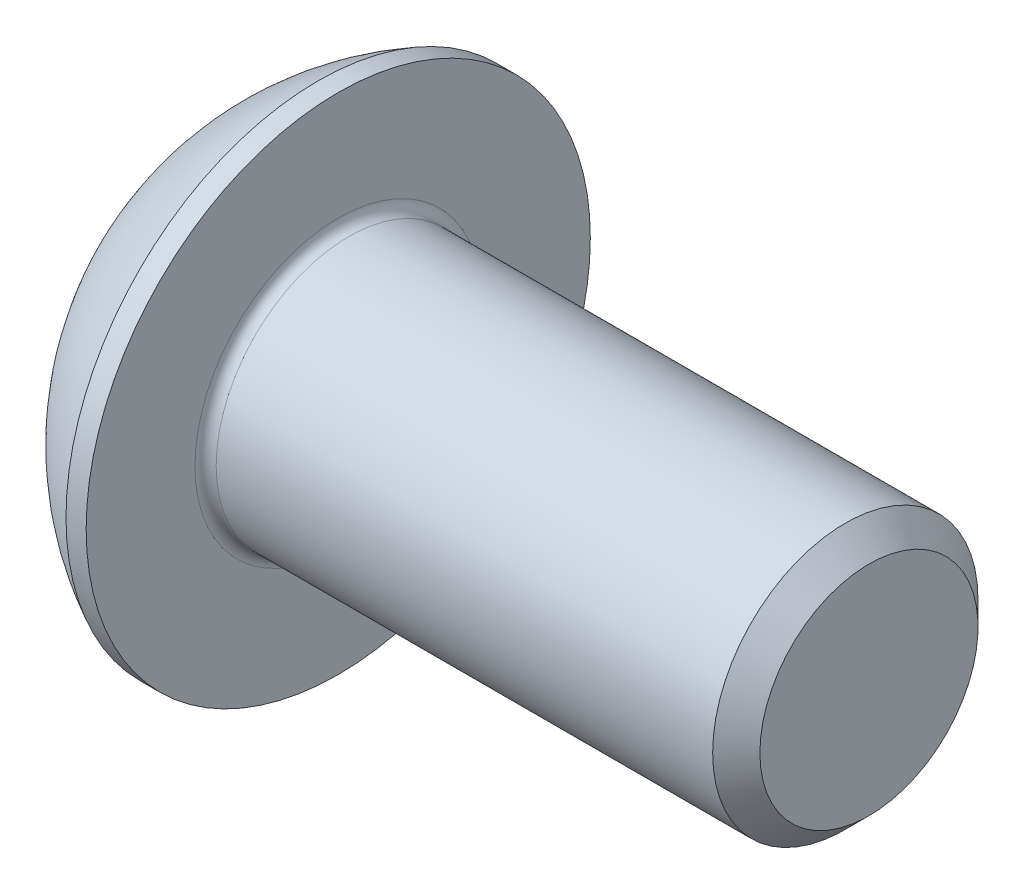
SolidWorks part; units mm, degrees
ref_plane "Plane1" through (0, 0, 0) normal (0, 0, 1) x (1, 0, 0)
ref_plane "Plane2" through (0, 0, 0) normal (0, 1, 0) x (1, 0, 0)
ref_plane "Plane3" through (0, 0, 0) normal (1, 0, 0) x (0, 0, -1)
other "Configuration Table"
sketch "BodySke" plane through (0, 0, 0) normal (0, 0, 1) x (1, 0, 0)
  line L0 (12.75, 0) -> (12.75, 2.055)
  line L1 (12.305, 2.5) -> (2.75, 2.5)
  line L2 (2.75, 2.5) -> (2.75, 4.75)
  line L3 (2.75, 4.75) -> (2.37, 4.75)
  line L4 (0, 0) -> (101.6, 0) construction
  line L5 (2.75, -4.75) -> (2.37, -4.75) construction
  line L6 (55.6768, -2.5) -> (2.75, -2.5) construction
  line L7 (12.75, 0) -> (0, 0)
  line L8 (0, 2.375) -> (0, -2.375) construction
  line L9 (0, 0) -> (0, 2.375)
  line L10 (12.75, 2.055) -> (12.305, 2.5)
  line L11 (12.75, -2.055) -> (12.305, -2.5) construction
  line L12 (3.55, 9.525) -> (3.55, -2.5) construction
  line L13 (2.75, 9.525) -> (2.75, -2.5) construction
  arc A1 (0, 2.375) -> (2.37, 4.75) centre (4.755, 0) cw
revolve "BaseBody" add sketch "BodySke" angle 360 about L4
fillet "Fillet1" radius 0.2 1 edges at (2.75, 0, 2.5)
sketch "Sketch2" plane through (0, 0, 0) normal (0, 0, 1) x (1, 0, 0)
  line L0 (0, 1.5) -> (1.56, 1.5)
  line L1 (1.56, 1.5) -> (2.426, 0)
  line L3 (2.426, 0) -> (0, 0)
  line L4 (0, 0) -> (0, 1.5)
  line L5 (0, -1.5) -> (1.56, -1.5) construction
  line L6 (0, 0) -> (47.625, 0) construction
  dimension "D2" = 60
  dimension "PreBroach_depth" = 1.56
  dimension "PreBroach_dia" = 3
revolve "PreBroach" cut sketch "Sketch2" angle 360 about L6
sketch "Sketch3" plane through (0, 0, 0) normal (1, 0, 0) x (0, 0, -1)
  line L0 (-1.5, -0.866) -> (-1.5, 0.866)
  line L1 (-1.5, 0.866) -> (0, 1.7321)
  line L2 (0, 1.7321) -> (1.5, 0.866)
  line L3 (1.5, 0.866) -> (1.5, -0.866)
  line L4 (1.5, -0.866) -> (0, -1.7321)
  line L5 (0, -1.7321) -> (-1.5, -0.866)
extrude "Hex" cut sketch "Sketch3" along normal blind 1.56
sketch "ThdSchSke" plane through (0, 0, 0) normal (0, 0, 1) x (1, 0, 0)
  line L0 (4.35, -2.055) -> (4.0384, -2.5)
  line L1 (4.35, -2.055) -> (4.6616, -2.5)
  line L2 (4.6616, -2.5) -> (4.6616, -3.125)
  line L3 (-3.175, 0) -> (5.1513, 0) construction
  line L5 (4.6616, -3.125) -> (4.0384, -3.125)
  line L6 (4.0384, -3.125) -> (4.0384, -2.5)
revolve "ThreadSchematic" [suppressed] cut sketch "ThdSchSke" angle 360 about L3
pattern_linear "ThdSchPat" [suppressed]
equation "\"D1@BodySke\" = \"Head_dia@BodySke\" * .5"
equation "\"Thread_minor@ThreadCosmetic\" = \"Minor_dia@BodySke\""
equation "\"D1@Sketch3\" = \"Hex_size@Sketch3\" / 2"
equation "\"D2@Sketch3\" = \"D1@Sketch3\""
equation "\"D3@Sketch3\" = \"Hex_size@Sketch3\""
equation "\"Thread_length@ThreadCosmetic\" = ((sgn( (\"Length@BodySke\" - \"Advance@BodySke\" * 2.0) - \"Thread_nom@BodySke\" )-1)*( (\"Length@BodySke\" - \"Advance@BodySke\" * 2.0) - \"Thread_nom@BodySke\" ))/-2+ \"Thread_no"
equation "\"Thread_minor@ThdSchSke\" = \"Minor_dia@BodySke\""
equation "\"Diameter@ThdSchSke\" = \"Diameter@BodySke\""
equation "\"Overcut@ThdSchSke\" = \"Diameter@BodySke\" * 1.25"
equation "\"Start@ThdSchSke\" = \"Head_ht@BodySke\" + \"Length@BodySke\" - \"Thread_length@ThreadCosmetic\"  '---Non-countersunk---"
equation "\"Num_threads@ThdSchPat\" = int( \"Thread_length@ThreadCosmetic\" / \"Advance@BodySke\" + 0.999 )  + 1"
equation "\"Advance@ThdSchPat\" = \"Thread_length@ThreadCosmetic\" /  (\"Num_threads@ThdSchPat\" - 1) 'relax it"
equation "\"Num_threads@ThdSchPat\" = \"Num_threads@ThdSchPat\" - sgn( \"Num_threads@ThdSchPat\" - 1) '---chamfered tips only---"
